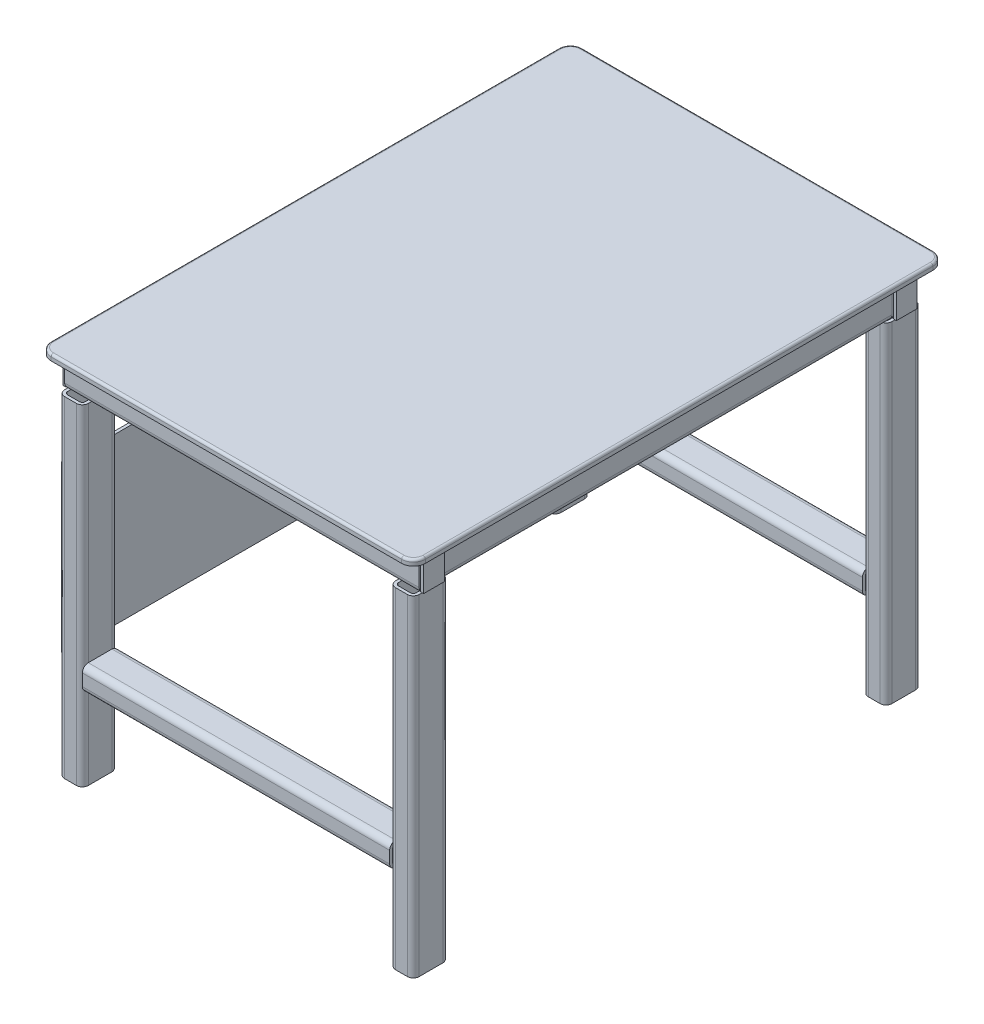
SolidWorks part; units mm, degrees
ref_plane "Front Plane" through (0, 0, 0) normal (0, 0, 1) x (1, 0, 0)
ref_plane "Top Plane" through (0, 0, 0) normal (0, 1, 0) x (1, 0, 0)
ref_plane "Right Plane" through (0, 0, 0) normal (1, 0, 0) x (0, 0, -1)
sketch "Sketch1"
  dimension "D1" = 711.2
  dimension "D2" = 1016
ref_plane "Plane3" through (0, 0, 508) normal (0, 0, 1) x (1, 0, 0)
sketch "Sketch2"
  dimension "D1" = 711.2
  dimension "D2" = 203.2
other "Structural Member1"
ref_plane "Plane1" through (0, 0, 508) normal (0, 0, -1) x (-1, 0, 0)
sketch "Sketch11"
  dimension "D1" = 12.7
  dimension "Thickness" = 6.35
  dimension "V_leg" = 76.2
  dimension "H_leg" = 50.8
other "Structural Member2"
ref_plane "Plane2" through (0, 0, 508) normal (0, -1, 0) x (1, 0, 0)
sketch "Sketch12"
  dimension "D1" = 12.7
  dimension "Thickness" = 6.35
  dimension "V_leg" = 76.2
  dimension "H_leg" = 50.8
other "End cap1" parameters "D1"=6.35, "D2"=3.175, "D3"=3.175
other "End cap2" parameters "D1"=6.35, "D2"=3.175, "D3"=3.175
other "End cap3" parameters "D1"=6.35, "D2"=3.175, "D3"=3.175
other "End cap4" parameters "D1"=6.35, "D2"=3.175, "D3"=3.175
mirror "Mirror1"
sketch "Sketch13"
  dimension "D1" = 25.4
extrude "Extrude1" add sketch "Sketch13" along normal blind 12.7 separate body
fillet "Fillet1" radius 5.08 8 edges at (-35.2182, 88.9, 563.0969) (-42.6577, 88.9, -0.2194) (-35.2182, 88.9, -563.5358) (359.4483, 88.9, -570.9753) (754.1148, 88.9, -563.5358) (761.5543, 88.9, -0.2194) (754.1148, 88.9, 563.0969) (359.4483, 88.9, 570.5364)
sketch "Sketch14"
extrude "Extrude2" add sketch "Sketch14" along normal blind 6.35 separate body
